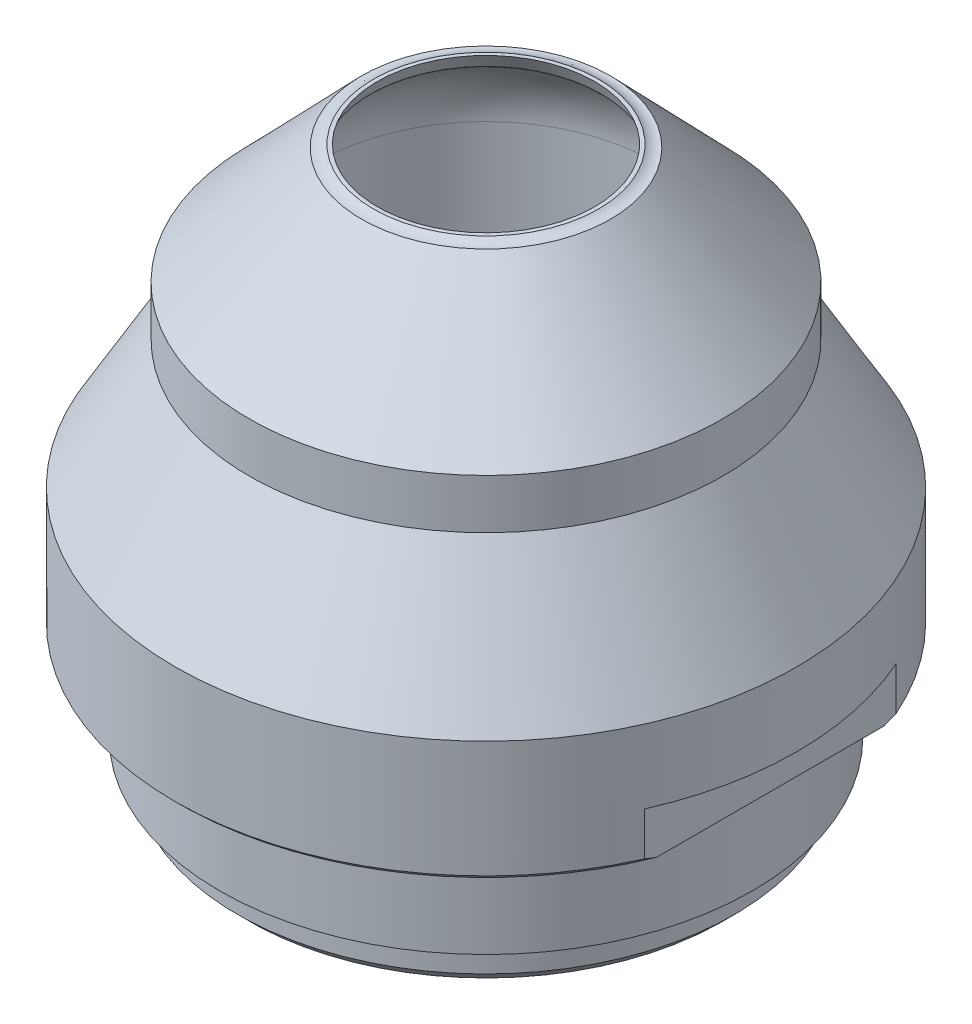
SolidWorks part; units mm, degrees
ref_plane "Спереди" through (0, 0, 0) normal (0, 0, 1) x (1, 0, 0)
ref_plane "Сверху" through (0, 0, 0) normal (0, 1, 0) x (1, 0, 0)
ref_plane "Справа" through (0, 0, 0) normal (1, 0, 0) x (0, 0, -1)
sketch "Эскиз1" plane through (0, 0, 0) normal (0, 0, 1) x (1, 0, 0)
  line L0 (0, 0) -> (0, 68.3472) construction
  line L1 (18.35, 93.7) -> (19, 93.7)
  line L2 (21, 93.2) -> (40, 73.5249)
  line L3 (40, 73.5249) -> (40, 65.1506)
  line L4 (40, 65.1506) -> (52.5, 43.5)
  line L5 (52.5, 43.5) -> (52.5, 23)
  line L6 (52.5, 23) -> (43, 23)
  line L7 (43, 23) -> (43, 20.7)
  line L8 (43, 20.7) -> (45, 20.7)
  line L9 (45, 20.7) -> (45, 7)
  line L10 (45, 7) -> (41.95, 7)
  line L11 (41.95, 7) -> (41.95, 0)
  line L12 (41.95, 0) -> (35, 0)
  line L13 (35, 0) -> (35, 26)
  line L14 (35, 26) -> (28.5, 50)
  line L15 (28.5, 50) -> (28.5, 76.8463)
  line L16 (19.5, 91.2338) -> (18.35, 93.7)
  arc A1 (28.5, 76.8463) -> (19.5, 91.2338) centre (12.5, 76.8463) ccw
  arc A2 (19, 93.7) -> (21, 93.2) centre (20.6833, 96.1832) ccw
  dimension "D3" = 0.5
  dimension "D15" = 134
  dimension "D17" = 16
  dimension "D25" = 3
  dimension "D1" = 105
  dimension "D2" = 70
  dimension "D4" = 80
  dimension "D5" = 93.7
  dimension "D6" = 57
  dimension "D7" = 36.7
  dimension "D8" = 26
  dimension "D9" = 50
  dimension "D10" = 23
  dimension "D11" = 20.5
  dimension "D12" = 8.3743
  dimension "D13" = 38
  dimension "D14" = 42
  dimension "D16" = 21.6506
  dimension "D18" = 2.4662
  dimension "D19" = 39
  dimension "D20" = 90
  dimension "D21" = 83.9
  dimension "D22" = 86
  dimension "D23" = 7
  dimension "D24" = 13.7
  dimension "D26" = 115
  dimension "D27" = 30
  dimension "D28" = 19.6751
  dimension "D29" = 2.3
  dimension "D30" = 70.7
  dimension "D31" = 20.1751
revolve "Повернуть1" add sketch "Эскиз1" angle 360 about L0
chamfer "Фаска1" distance 2 angle 45 1 edges at (0, 0, -41.95)
fillet "Скругление1" radius 0.25 4 edges at (0, 91.2338, -19.5) (0, 26, -35) (0, 50, -28.5) (0, 0, -35)
chamfer "Фаска2" distance 0.8 angle 45 1 edges at (0, 23, -52.5)
sketch "Эскиз2" plane through (0, 23, 0) normal (0, -1, 0) x (1, 0, 0)
  line L1 (48, -52.5) -> (-48, -52.5)
  line L2 (48, -52.5) -> (48, 52.5)
  line L3 (48, 52.5) -> (-48, 52.5)
  line L4 (-48, -52.5) -> (-48, 52.5)
  line L5 (0, 52.5) -> (0, -52.5) construction
  line L6 (48, 0) -> (-48, 0) construction
  circle A0 centre (0, 0) radius 52.5 construction
  point P0 (0, 0)
  dimension "D1" = 96
extrude "Вырез-Вытянуть1" cut sketch "Эскиз2" against normal blind 8.1 flip side to cut
